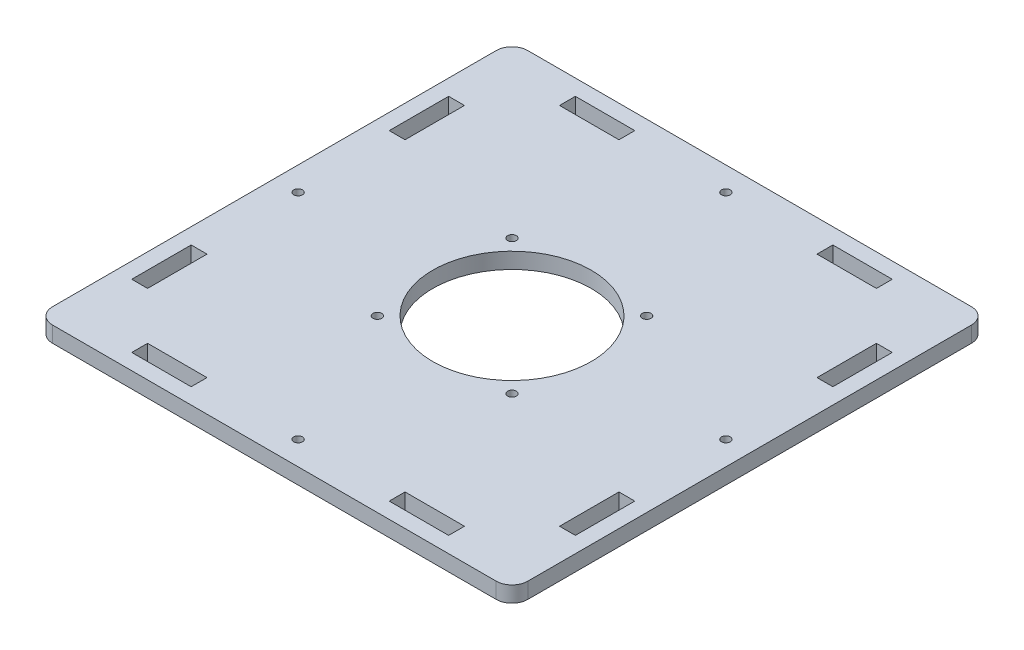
SolidWorks part; units mm, degrees
ref_plane "Ebene vorne" through (0, 0, 0) normal (0, 0, 1) x (1, 0, 0)
ref_plane "Ebene oben" through (0, 0, 0) normal (0, 1, 0) x (1, 0, 0)
ref_plane "Ebene rechts" through (0, 0, 0) normal (1, 0, 0) x (0, 0, -1)
sketch "Skizze1" plane through (0, 0, 0) normal (0, 1, 0) x (1, 0, 0)
  line L0 (0, 64.3448) -> (0, -69.9367) construction
  line L1 (-56, 60) -> (56, 60)
  line L2 (-60, 56) -> (-60, -56)
  line L3 (-56, -60) -> (56, -60)
  line L4 (60, 56) -> (60, -56)
  line L5 (-63.2683, 0) -> (64.2442, 0) construction
  line L6 (25, 56) -> (25, 52)
  line L7 (-40, 56) -> (-25, 56)
  line L8 (-40, 56) -> (-40, 52)
  line L9 (-40, 52) -> (-25, 52)
  line L10 (-25, 56) -> (-25, 52)
  line L11 (40, 52) -> (25, 52)
  line L12 (40, 56) -> (40, 52)
  line L13 (40, 56) -> (25, 56)
  line L14 (56, -25) -> (52, -25)
  line L15 (56, 40) -> (56, 25)
  line L16 (56, 40) -> (52, 40)
  line L17 (52, 40) -> (52, 25)
  line L18 (56, 25) -> (52, 25)
  line L19 (52, -40) -> (52, -25)
  line L20 (56, -40) -> (52, -40)
  line L21 (56, -40) -> (56, -25)
  line L22 (-25, -56) -> (-25, -52)
  line L23 (40, -56) -> (25, -56)
  line L24 (40, -56) -> (40, -52)
  line L25 (40, -52) -> (25, -52)
  line L26 (25, -56) -> (25, -52)
  line L27 (-40, -52) -> (-25, -52)
  line L28 (-40, -56) -> (-40, -52)
  line L29 (-40, -56) -> (-25, -56)
  line L30 (-56, 25) -> (-52, 25)
  line L31 (-56, -40) -> (-56, -25)
  line L32 (-56, -40) -> (-52, -40)
  line L33 (-52, -40) -> (-52, -25)
  line L34 (-56, -25) -> (-52, -25)
  line L35 (-52, 40) -> (-52, 25)
  line L36 (-56, 40) -> (-52, 40)
  line L37 (-56, 40) -> (-56, 25)
  circle A0 centre (0, 0) radius 20
  circle A1 centre (-17, 17) radius 1.1
  circle A2 centre (17, 17) radius 1.1
  arc A3 (-60, -56) -> (-56, -60) centre (-56, -56) ccw
  arc A4 (60, -56) -> (56, -60) centre (56, -56) cw
  arc A5 (56, 60) -> (60, 56) centre (56, 56) cw
  arc A6 (-56, 60) -> (-60, 56) centre (-56, 56) ccw
  circle A7 centre (17, -17) radius 1.1
  circle A8 centre (-17, -17) radius 1.1
  circle A9 centre (0, 54) radius 1.1
  circle A10 centre (54, 0) radius 1.1
  circle A11 centre (0, -54) radius 1.1
  circle A12 centre (-54, 0) radius 1.1
  point P25 (-60, -60)
  point P50 (0, 0)
  point P55 (60, 60)
  point P58 (-60, 60)
  point P74 (0, 0)
  dimension "D3" = 40
  dimension "D4" = 2.2
  dimension "D11" = 4
  dimension "D13" = 2.2
  dimension "D15" = 4
  dimension "D1" = 120
  dimension "D2" = 120
  dimension "D5" = 34
  dimension "D6" = 4
  dimension "D7" = 4
  dimension "D8" = 15
  dimension "D9" = 25
  dimension "D12" = 34
  dimension "D14" = 6
  dimension "D10" = 4
extrude "Aufsatz-Linear austragen1" add sketch "Skizze1" along normal blind 4
